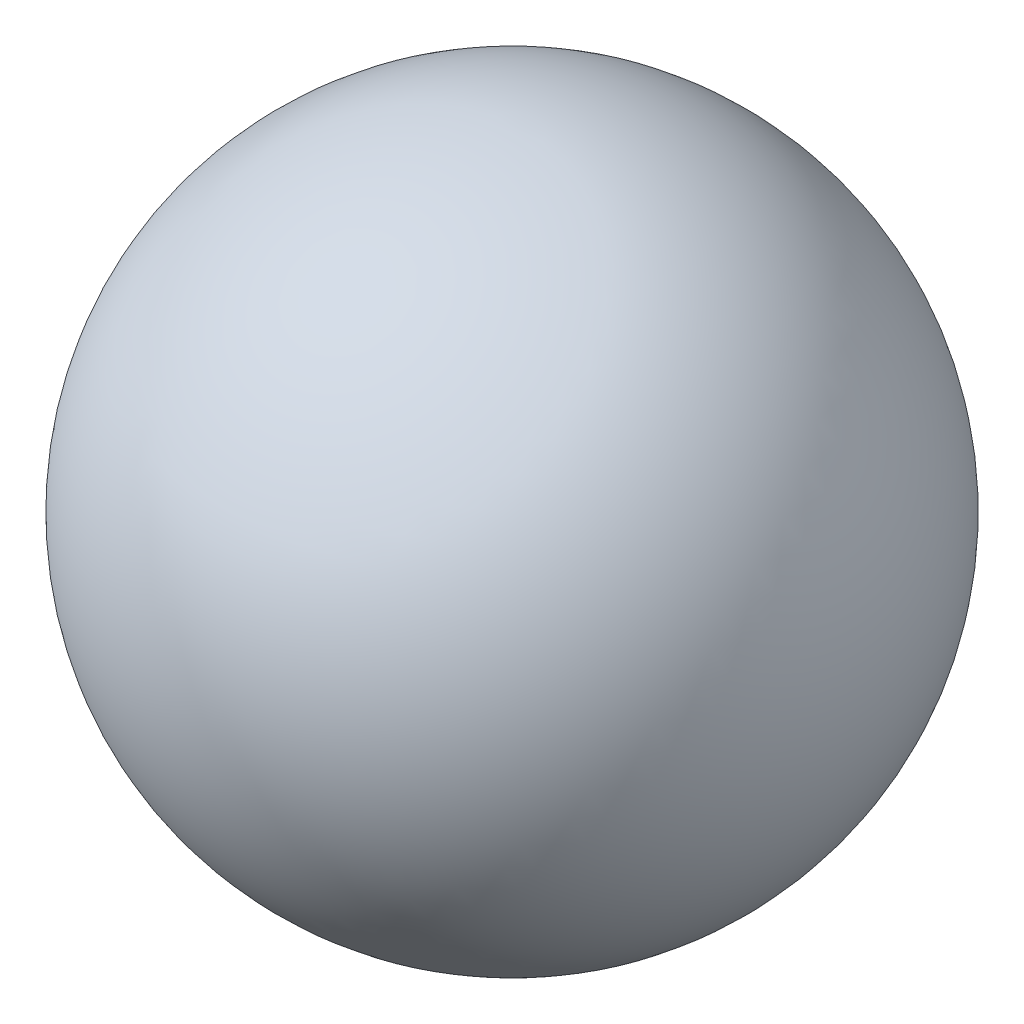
SolidWorks part; units mm, degrees
ref_plane "Front Plane" through (0, 0, 0) normal (0, 0, 1) x (1, 0, 0)
ref_plane "Top Plane" through (0, 0, 0) normal (0, 1, 0) x (1, 0, 0)
ref_plane "Right Plane" through (0, 0, 0) normal (1, 0, 0) x (0, 0, -1)
sketch "Sketch1" plane through (0, 0, 0) normal (0, 0, 1) x (1, 0, 0)
  line L4 (0, 9.652) -> (0, -9.652)
  arc A2 (0, 9.652) -> (0, -9.652) centre (0, 0) cw
  point P7 (0, 0)
  dimension "D1" = 19.304
revolve "Revolve1" add sketch "Sketch1" angle 360 about L4
